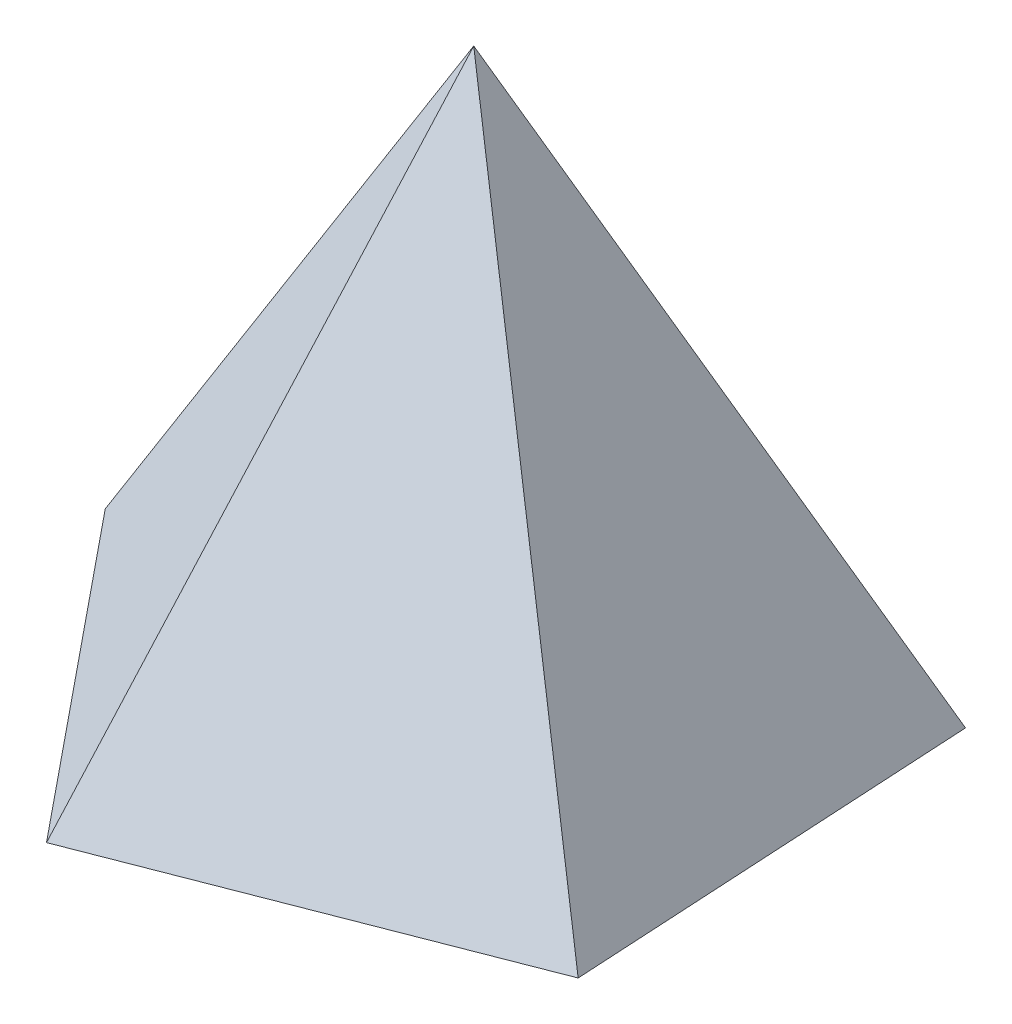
SolidWorks part; units mm, degrees
ref_plane "前视基准面" through (0, 0, 0) normal (0, 0, 1) x (1, 0, 0)
ref_plane "上视基准面" through (0, 0, 0) normal (0, 1, 0) x (1, 0, 0)
ref_plane "右视基准面" through (0, 0, 0) normal (1, 0, 0) x (0, 0, -1)
other "Configuration Table"
sketch "草图1" plane through (0, 0, 0) normal (0, 1, 0) x (1, 0, 0)
  line L1 (51.9486, -33.4813) -> (47.8957, 39.0598)
  line L2 (47.8957, 39.0598) -> (-22.3475, 57.6216)
  line L3 (-22.3475, 57.6216) -> (-61.7072, -3.4477)
  line L4 (-61.7072, -3.4477) -> (-15.7896, -59.7524)
  line L5 (-15.7896, -59.7524) -> (51.9486, -33.4813)
  circle A0 centre (0, 0) radius 50 construction
  point P1 (0, 0)
sketch "草图3" plane through (0, 0, 0) normal (0, 0, 1) x (1, 0, 0)
  line L0 (0, 0) -> (0, 100) construction
  point P5 (0, 100)
loft "放样1" add profiles "草图3", "草图1"
